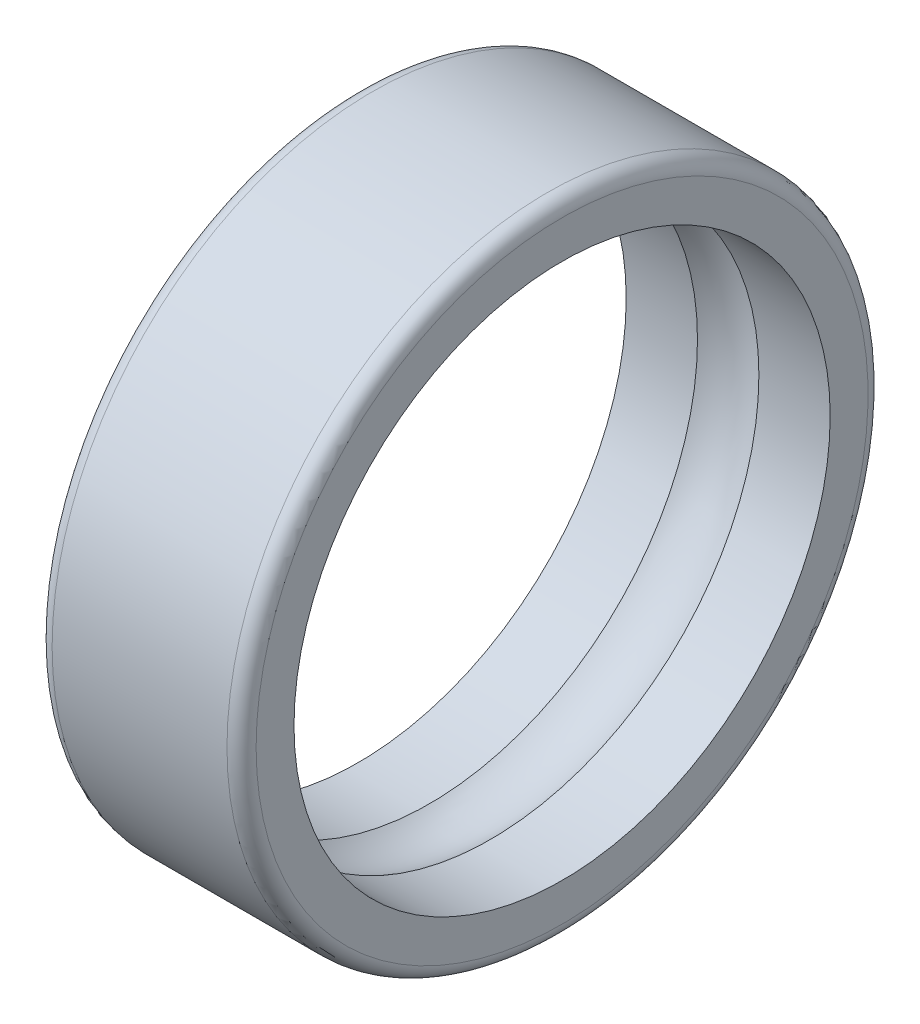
SolidWorks part; units mm, degrees
ref_plane "Face" through (0, 0, 0) normal (0, 0, 1) x (1, 0, 0)
ref_plane "Dessus" through (0, 0, 0) normal (0, 1, 0) x (1, 0, 0)
ref_plane "Droite" through (0, 0, 0) normal (1, 0, 0) x (0, 0, -1)
sketch "Esquisse1" plane through (0, 0, 0) normal (0, 0, 1) x (1, 0, 0)
  line L0 (1.0536, 9.2) -> (3.5, 9.2)
  line L1 (-3, 11) -> (3, 11)
  line L2 (-3.5, 10.5) -> (-3.5, 9.2)
  line L3 (-3.5, 9.2) -> (-1.0536, 9.2)
  line L4 (3.5, 10.5) -> (3.5, 9.2)
  line L5 (-4.3709, 0) -> (4.0553, 0) construction
  arc A0 (1.0536, 9.2) -> (-1.0536, 9.2) centre (0, 7.5) ccw
  arc A1 (3, 11) -> (3.5, 10.5) centre (3, 10.5) cw
  arc A2 (-3.5, 10.5) -> (-3, 11) centre (-3, 10.5) cw
  dimension "D6" = 3.5
  dimension "D7" = 0.5
  dimension "D8" = 0.5
  dimension "D3" = 2
  dimension "D4" = 7
  dimension "D1" = 1.8
  dimension "D2" = 11
  dimension "D5" = 7.5
revolve "Base-Révolution" add sketch "Esquisse1" angle 360 about L5
